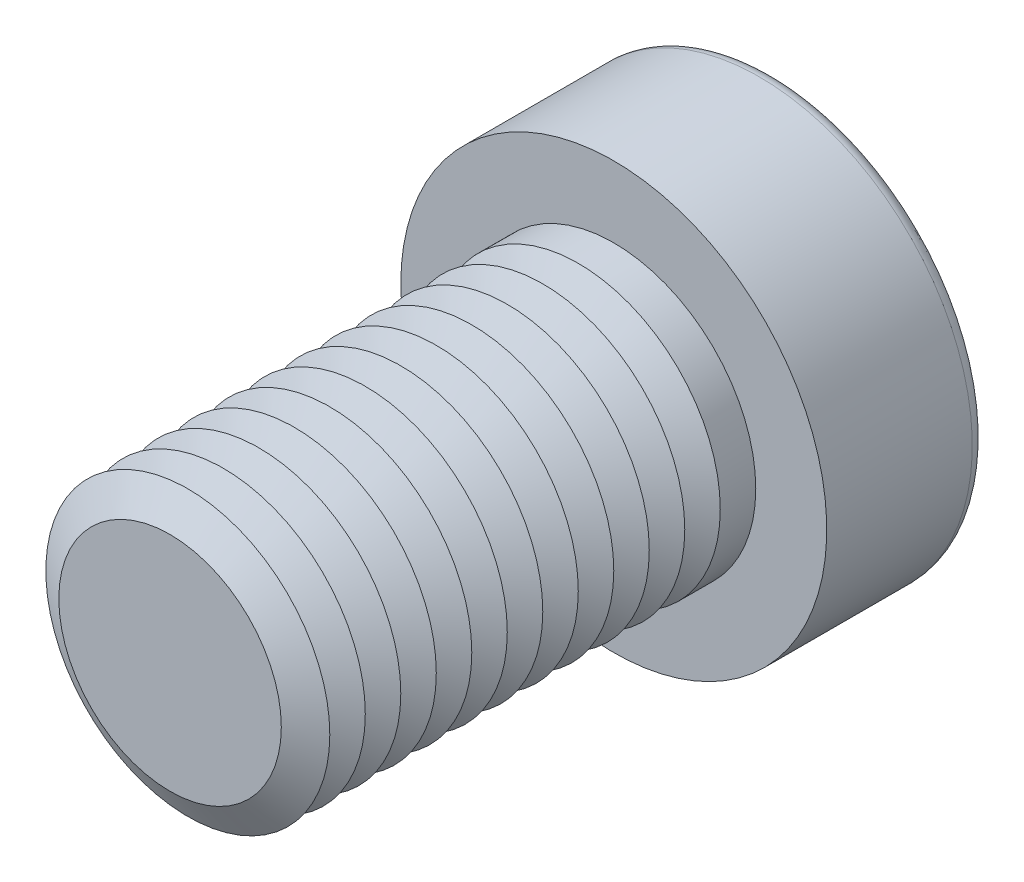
SolidWorks part; units mm, degrees
ref_plane "Front Plane" through (0, 0, 0) normal (0, 0, 1) x (1, 0, 0)
ref_plane "Top Plane" through (0, 0, 0) normal (0, 1, 0) x (1, 0, 0)
ref_plane "Right Plane" through (0, 0, 0) normal (1, 0, 0) x (0, 0, -1)
sketch "Sketch1" plane through (0, 0, 0) normal (0, 0, 1) x (1, 0, 0)
  circle A0 centre (0, 0) radius 8
  dimension "D1" = 16
extrude "Boss-Extrude1" add sketch "Sketch1" along normal blind 25
sketch "Sketch2" plane through (0, 0, 0) normal (0, 0, -1) x (-1, 0, 0)
  circle A0 centre (0, 0) radius 12
  dimension "D1" = 24
extrude "Boss-Extrude2" add sketch "Sketch2" along normal blind 9
sketch "Sketch3" plane through (0, 0, -9) normal (0, 0, -1) x (-1, 0, 0)
  line L1 (-3.4641, 6) -> (-6.9282, 0)
  line L2 (-6.9282, 0) -> (-3.4641, -6)
  line L3 (-3.4641, -6) -> (3.4641, -6)
  line L4 (3.4641, -6) -> (6.9282, 0)
  line L5 (6.9282, 0) -> (3.4641, 6)
  line L6 (3.4641, 6) -> (-3.4641, 6)
  circle A0 centre (0, 0) radius 6 construction
  dimension "D1" = 12
extrude "Cut-Extrude1" cut sketch "Sketch3" against normal blind 9
fillet "Fillet1" radius 0.8 1 edges at (-12, 0, -9)
sketch "Sketch4" plane through (0, 0, 0) normal (0, 0, -1) x (-1, 0, 0)
  line L0 (3.4641, -6) -> (6.9282, 0) construction
  circle A0 centre (0, 0) radius 6
extrude "Cut-Extrude2" cut sketch "Sketch4" against normal through all draft 60
sketch "Sketch5" plane through (0, 0, -9) normal (0, 0, -1) x (-1, 0, 0)
  circle A0 centre (0, 0) radius 6.9282
extrude "Cut-Extrude3" cut sketch "Sketch5" against normal through all draft 75
sketch "Sketch7" plane through (0, 0, 0) normal (1, 0, 0) x (0, 0, -1)
  line L25 (-25, 6.2679) -> (-24, 8)
  line L26 (-25, 8) -> (-25, -8) construction
  line L27 (-24, 8) -> (-26, 8)
  line L28 (-26, 8) -> (-25, 6.2679)
  line L29 (0, 8) -> (-25, 8) construction
  dimension "D1" = 2
revolve "Cut-Revolve1" cut sketch "Sketch7" angle 360 about axis through (0, 0, 25) along (0, 0, -1)
pattern_linear "LPattern1" count 12 spacing 2 along (0, 0, -1) of "Cut-Revolve1"
